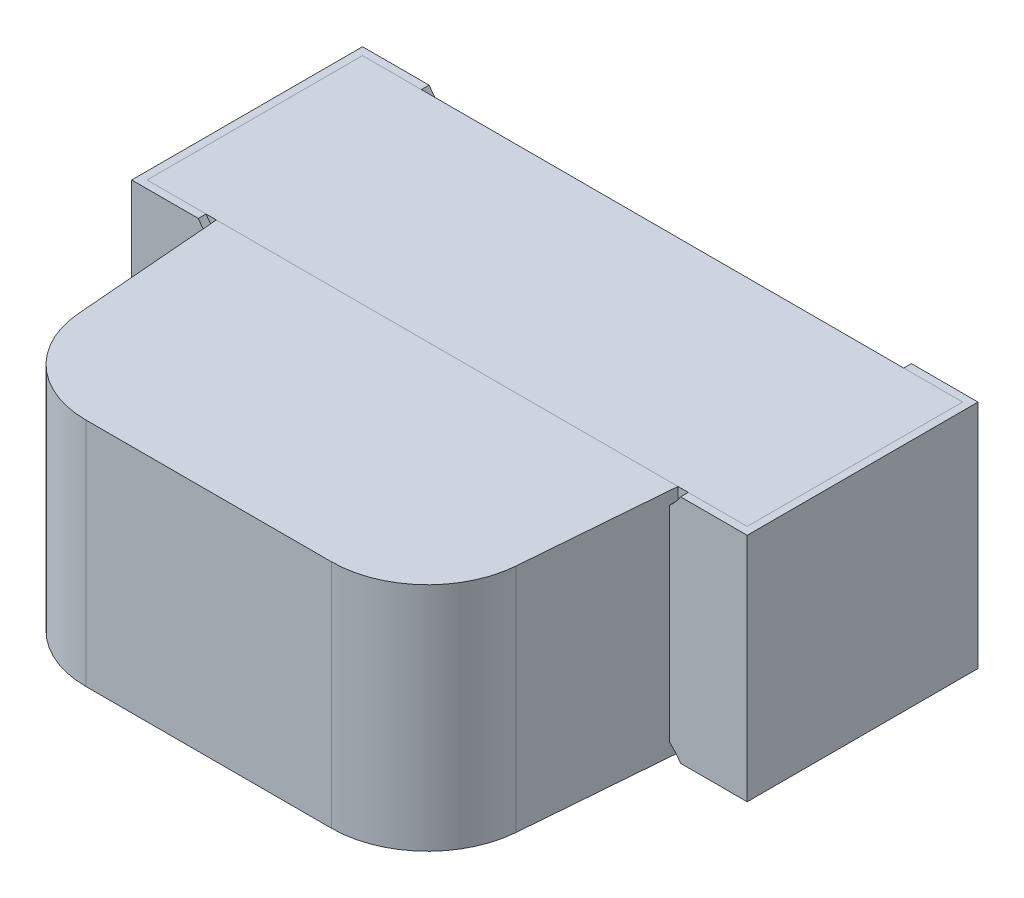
SolidWorks part; units mm, degrees
ref_plane "Front" through (0, 0, 0) normal (0, 0, 1) x (1, 0, 0)
ref_plane "Top" through (0, 0, 0) normal (0, 1, 0) x (1, 0, 0)
ref_plane "Right" through (0, 0, 0) normal (1, 0, 0) x (0, 0, -1)
sketch "Sketch1" plane through (0, 0, 0) normal (0, 1, 0) x (1, 0, 0)
  line L0 (-0.78, 0) -> (0.78, 0) construction
  line L1 (-0.78, 0.28) -> (0.78, 0.28)
  line L2 (-0.78, 0.28) -> (-0.78, -0.28)
  line L3 (-0.78, -0.28) -> (0.78, -0.28)
  line L4 (0.78, 0.28) -> (0.78, -0.28)
  dimension "D1" = 1.56
  dimension "D2" = 0.56
extrude "Extrude1" add sketch "Sketch1" along normal blind 0.6
sketch "Sketch2" plane through (0, 0, 0) normal (0, 1, 0) x (1, 0, 0)
  line L0 (0.8, 0.3) -> (0.55, 0.3)
  line L1 (-0.8, 0.3) -> (-0.8, -0.3)
  line L2 (-0.8, -0.3) -> (-0.55, -0.3)
  line L3 (0.8, -0.3) -> (0.8, 0.3)
  line L4 (0.78, 0.28) -> (-0.78, 0.28)
  line L5 (0.78, -0.28) -> (0.78, 0.28)
  line L6 (-0.78, -0.28) -> (0.78, -0.28)
  line L7 (-0.78, 0.28) -> (-0.78, -0.28)
  line L8 (0.78, 0.28) -> (0.55, 0.28)
  line L9 (0.78, -0.28) -> (0.78, 0.28)
  line L10 (-0.78, -0.28) -> (-0.55, -0.28)
  line L11 (-0.78, 0.28) -> (-0.78, -0.28)
  line L12 (-0.55, 0.3) -> (-0.55, 0.28)
  line L13 (0, 0) -> (0, -0.28) construction
  line L14 (0.55, 0.3) -> (0.55, 0.28)
  line L15 (-0.55, 0.3) -> (-0.8, 0.3)
  line L16 (-0.55, 0.28) -> (-0.78, 0.28)
  line L17 (0.8, 0.3) -> (-0.8, 0.3) construction
  line L18 (0.55, -0.28) -> (0.78, -0.28)
  line L19 (0.78, 0.28) -> (-0.78, 0.28) construction
  line L20 (0.55, -0.3) -> (0.8, -0.3)
  line L21 (-0.78, -0.28) -> (0.78, -0.28) construction
  line L22 (-0.55, -0.28) -> (-0.55, -0.3)
  line L23 (-0.8, -0.3) -> (0.8, -0.3) construction
  line L24 (0.55, -0.28) -> (0.55, -0.3)
  line L25 (-0.78, -0.28) -> (0.78, -0.28) construction
  dimension "D3" = 0.25
  dimension "D2" = 1.6
  dimension "D1" = 0
extrude "Extrude2" add sketch "Sketch2" along normal blind 0.6 separate body
sketch "Sketch4" plane through (0, 0, 0.3) normal (0, 0, 1) x (1, 0, 0)
  line L0 (-0.55, 0.3) -> (0.55, 0.3) construction
  line L1 (-0.55, 0.6) -> (-0.55, 0) construction
  line L2 (0.55, 0.6) -> (0.55, 0) construction
  line L3 (0, 0) -> (0, 0.6) construction
  line L4 (-0.78, 0.6) -> (0.78, 0.6) construction
  circle A0 centre (-0.5, 0.68) radius 0.15
  circle A1 centre (0.5, 0.68) radius 0.15
  circle A2 centre (0.5, -0.08) radius 0.15
  circle A3 centre (-0.5, -0.08) radius 0.15
  dimension "D1" = 0.5
  dimension "D2" = 0.38
  dimension "D3" = 0.3
extrude "Extrude4" cut sketch "Sketch4" against normal through all
sketch "Sketch3" plane through (0, 0, 0) normal (0, 1, 0) x (1, 0, 0)
  line L0 (-0.78, -0.28) -> (0.78, -0.28) construction
  line L1 (-0.6, -0.28) -> (0.6, -0.28)
  line L2 (-0.6, -0.28) -> (-0.5685, -0.6701)
  line L3 (-0.3193, -0.9) -> (0.3193, -0.9)
  line L4 (0.6, -0.28) -> (0.5685, -0.6701)
  line L5 (0, 0) -> (0, -0.9) construction
  line L6 (-0.6269, 0.3) -> (-0.8, 0.3) construction
  arc A0 (0.3193, -0.9) -> (0.5685, -0.6701) centre (0.3193, -0.65) ccw
  arc A1 (-0.5685, -0.6701) -> (-0.3193, -0.9) centre (-0.3193, -0.65) ccw
  point P13 (0.55, -0.9)
  point P16 (-0.55, -0.9)
  dimension "D4" = 0.25
  dimension "D1" = 1.1
  dimension "D2" = 1.2
  dimension "D3" = 1.2
extrude "Extrude3" add sketch "Sketch3" along normal blind 0.6 separate body
sketch "Sketch5" plane through (0, 0, -0.28) normal (0, 0, -1) x (-1, 0, 0)
  line L0 (-0.8, 0.3) -> (0.8, 0.3) construction
  line L1 (-0.4, 0.05) -> (-0.1, 0.05)
  line L2 (-0.4, 0.05) -> (-0.4, 0.55)
  line L3 (-0.4, 0.55) -> (-0.1, 0.55)
  line L4 (-0.1, 0.05) -> (-0.1, 0.55)
  line L5 (-0.8, 0.6) -> (-0.8, 0) construction
  line L6 (0.8, 0.6) -> (0.8, 0) construction
  dimension "D1" = 0.1
  dimension "D2" = 0.3
  dimension "D3" = 0.5
extrude "Extrude5" cut sketch "Sketch5" against normal blind 0.01
